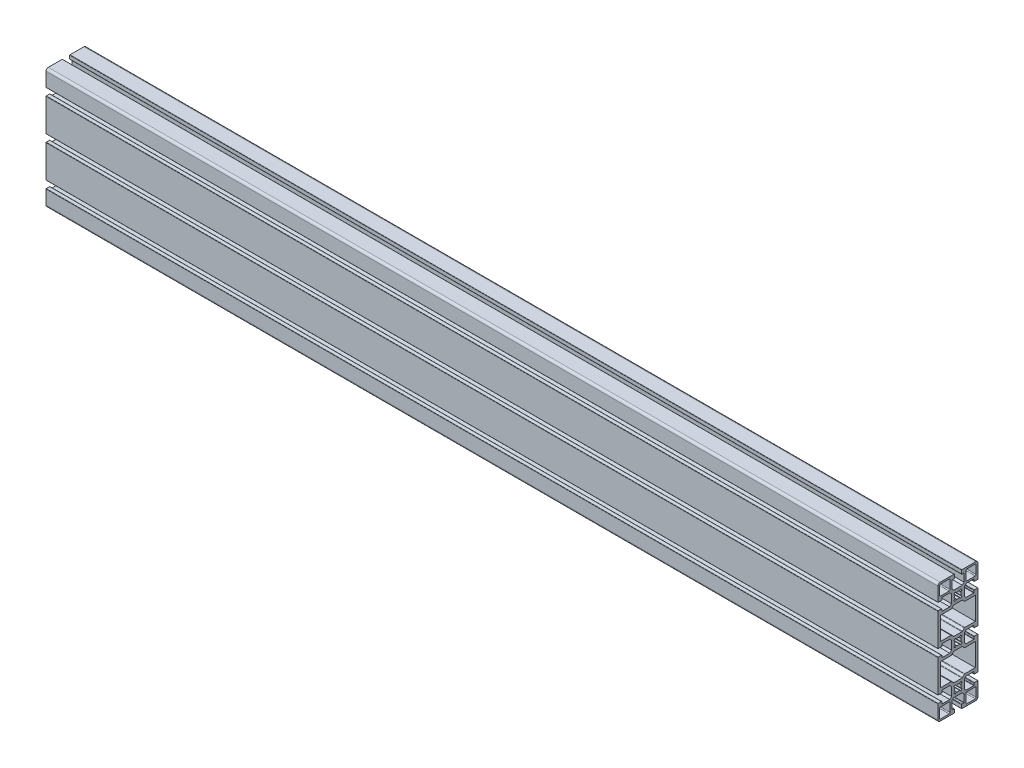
SolidWorks part; units mm, degrees
ref_plane "Front Plane" through (0, 0, 0) normal (0, 0, 1) x (1, 0, 0)
ref_plane "Top Plane" through (0, 0, 0) normal (0, 1, 0) x (1, 0, 0)
ref_plane "Right Plane" through (0, 0, 0) normal (1, 0, 0) x (0, 0, -1)
sketch3d "3DSketch1"
  line L0 (0, 0, 0) -> (1000, 0, 0)
  dimension "D1" = 1000
other "45-sarja 1.0115 45X135 L 6M MUSTA(1)"
ref_plane "Plane1" through (0, 0, 0) normal (1, 0, 0) x (0, 0, -1)
sketch "Sketch12" plane through (0, 0, 0) normal (1, 0, 0) x (0, 0, -1)
  line L0 (9.8, 53.9275) -> (19.5, 53.9275)
  line L1 (20.5, 54.9275) -> (20.5, 64.6275)
  line L2 (19.5, 65.6275) -> (9.8, 65.6275)
  line L3 (8.8, 64.6275) -> (8.8, 54.9275)
  line L4 (-20.5, 64.6275) -> (-20.5, 54.9275)
  line L5 (-19.5, 53.9275) -> (-9.8, 53.9275)
  line L6 (-8.8, 54.9275) -> (-8.8, 64.6275)
  line L7 (-9.8, 65.6275) -> (-19.5, 65.6275)
  line L8 (-4.3841, 48.0973) -> (-3.3633, 47.0766)
  line L9 (-3.3633, 43.1784) -> (-4.3841, 42.1576)
  line L10 (-4.3841, 41.7334) -> (-3.3941, 40.7434)
  line L11 (-2.9698, 40.7434) -> (-1.9491, 41.7642)
  line L12 (1.9491, 41.7642) -> (2.9698, 40.7434)
  line L13 (3.3941, 40.7434) -> (4.3841, 41.7334)
  line L14 (4.3841, 42.1576) -> (3.3633, 43.1784)
  line L15 (3.3633, 47.0766) -> (4.3841, 48.0973)
  line L16 (4.3841, 48.5216) -> (3.3941, 49.5115)
  line L17 (2.9698, 49.5115) -> (1.9491, 48.4908)
  line L18 (-1.9491, 48.4908) -> (-2.9698, 49.5115)
  line L19 (-3.3941, 49.5115) -> (-4.3841, 48.5216)
  line L20 (-5.0929, 37.6346) -> (-7.1071, 35.6204)
  line L21 (4.3858, 37.9275) -> (-4.3858, 37.9275)
  line L22 (7.1071, 35.6204) -> (5.0929, 37.6346)
  line L23 (19.5, 35.3275) -> (7.8142, 35.3275)
  line L24 (19.5, 9.9275) -> (19.5, 35.3275)
  line L25 (7.8142, 9.9275) -> (19.5, 9.9275)
  line L26 (5.0929, 7.6204) -> (7.1071, 9.6346)
  line L27 (-4.3858, 7.3275) -> (4.3858, 7.3275)
  line L28 (-7.1071, 9.6346) -> (-5.0929, 7.6204)
  line L29 (-19.5, 9.9275) -> (-7.8142, 9.9275)
  line L30 (-19.5, 35.3275) -> (-19.5, 9.9275)
  line L31 (-7.8142, 35.3275) -> (-19.5, 35.3275)
  line L32 (-4.3841, 3.0973) -> (-3.3633, 2.0766)
  line L33 (-3.3633, -1.8216) -> (-4.3841, -2.8424)
  line L34 (-4.3841, -3.2666) -> (-3.3941, -4.2566)
  line L35 (-2.9698, -4.2566) -> (-1.9491, -3.2358)
  line L36 (1.9491, -3.2358) -> (2.9698, -4.2566)
  line L37 (3.3941, -4.2566) -> (4.3841, -3.2666)
  line L38 (4.3841, -2.8424) -> (3.3633, -1.8216)
  line L39 (3.3633, 2.0766) -> (4.3841, 3.0973)
  line L40 (-18.5, 41.0275) -> (-22.2, 41.0275)
  line L41 (-22.5, 40.7275) -> (-22.5, 4.5275)
  line L42 (-22.2, 4.2275) -> (-18.5, 4.2275)
  line L43 (-18, 4.7275) -> (-18, 6.6275)
  line L44 (-17.7, 6.9275) -> (-9.2, 6.9275)
  line L45 (-9.2, 6.9275) -> (-7.2, 4.9275)
  line L46 (-7.2, 4.9275) -> (-7.2, -4.6725)
  line L47 (-7.2, -4.6725) -> (-9.2, -6.6725)
  line L48 (-9.2, -6.6725) -> (-17.7, -6.6725)
  line L49 (-18, -6.3725) -> (-18, -4.4725)
  line L50 (-18.5, -3.9725) -> (-22.2, -3.9725)
  line L51 (-22.5, -4.2725) -> (-22.5, -40.4725)
  line L52 (-22.2, -40.7725) -> (-18.5, -40.7725)
  line L53 (-18, -40.2725) -> (-18, -38.3725)
  line L54 (-17.7, -38.0725) -> (-9.2, -38.0725)
  line L55 (-9.2, -38.0725) -> (-7.2, -40.0725)
  line L56 (-7.2, -40.0725) -> (-7.2, -49.6725)
  line L57 (-7.2, -49.6725) -> (-9.2, -51.6725)
  line L58 (-9.2, -51.6725) -> (-17.7, -51.6725)
  line L59 (-18, -51.3725) -> (-18, -49.4725)
  line L60 (-18.5, -48.9725) -> (-22.2, -48.9725)
  line L61 (-22.5, -49.2725) -> (-22.5, -64.8725)
  line L62 (-20, -67.3725) -> (-4.4, -67.3725)
  line L63 (-4.1, -67.0725) -> (-4.1, -63.3725)
  line L64 (-4.6, -62.8725) -> (-6.5, -62.8725)
  line L65 (-6.8, -62.5725) -> (-6.8, -54.0725)
  line L66 (-6.8, -54.0725) -> (-4.8, -52.0725)
  line L67 (-4.8, -52.0725) -> (4.8, -52.0725)
  line L68 (4.8, -52.0725) -> (6.8, -54.0725)
  line L69 (6.8, -54.0725) -> (6.8, -62.5725)
  line L70 (6.5, -62.8725) -> (4.6, -62.8725)
  line L71 (4.1, -63.3725) -> (4.1, -67.0725)
  line L72 (4.4, -67.3725) -> (20, -67.3725)
  line L73 (22.5, -64.8725) -> (22.5, -49.2725)
  line L74 (22.2, -48.9725) -> (18.5, -48.9725)
  line L75 (18, -49.4725) -> (18, -51.3725)
  line L76 (17.7, -51.6725) -> (9.2, -51.6725)
  line L77 (9.2, -51.6725) -> (7.2, -49.6725)
  line L78 (7.2, -49.6725) -> (7.2, -40.0725)
  line L79 (7.2, -40.0725) -> (9.2, -38.0725)
  line L80 (9.2, -38.0725) -> (17.7, -38.0725)
  line L81 (18, -38.3725) -> (18, -40.2725)
  line L82 (18.5, -40.7725) -> (22.2, -40.7725)
  line L83 (22.5, -40.4725) -> (22.5, -4.2725)
  line L84 (22.2, -3.9725) -> (18.5, -3.9725)
  line L85 (18, -4.4725) -> (18, -6.3725)
  line L86 (17.7, -6.6725) -> (9.2, -6.6725)
  line L87 (9.2, -6.6725) -> (7.2, -4.6725)
  line L88 (7.2, -4.6725) -> (7.2, 4.9275)
  line L89 (7.2, 4.9275) -> (9.2, 6.9275)
  line L90 (9.2, 6.9275) -> (17.7, 6.9275)
  line L91 (18, 6.6275) -> (18, 4.7275)
  line L92 (18.5, 4.2275) -> (22.2, 4.2275)
  line L93 (22.5, 4.5275) -> (22.5, 40.7275)
  line L94 (22.2, 41.0275) -> (18.5, 41.0275)
  line L95 (18, 40.5275) -> (18, 38.6275)
  line L96 (17.7, 38.3275) -> (9.2, 38.3275)
  line L97 (9.2, 38.3275) -> (7.2, 40.3275)
  line L98 (7.2, 40.3275) -> (7.2, 49.9275)
  line L99 (7.2, 49.9275) -> (9.2, 51.9275)
  line L100 (9.2, 51.9275) -> (17.7, 51.9275)
  line L101 (18, 51.6275) -> (18, 49.7275)
  line L102 (18.5, 49.2275) -> (22.2, 49.2275)
  line L103 (22.5, 49.5275) -> (22.5, 65.1275)
  line L104 (20, 67.6275) -> (4.4, 67.6275)
  line L105 (4.1, 67.3275) -> (4.1, 63.6275)
  line L106 (4.6, 63.1275) -> (6.5, 63.1275)
  line L107 (6.8, 62.8275) -> (6.8, 54.3275)
  line L108 (6.8, 54.3275) -> (4.8, 52.3275)
  line L109 (4.8, 52.3275) -> (-4.8, 52.3275)
  line L110 (-4.8, 52.3275) -> (-6.8, 54.3275)
  line L111 (-6.8, 54.3275) -> (-6.8, 62.8275)
  line L112 (-6.5, 63.1275) -> (-4.6, 63.1275)
  line L113 (-4.1, 63.6275) -> (-4.1, 67.3275)
  line L114 (-4.4, 67.6275) -> (-20, 67.6275)
  line L115 (-22.5, 65.1275) -> (-22.5, 49.5275)
  line L116 (-22.2, 49.2275) -> (-18.5, 49.2275)
  line L117 (-18, 49.7275) -> (-18, 51.6275)
  line L118 (-17.7, 51.9275) -> (-9.2, 51.9275)
  line L119 (-9.2, 51.9275) -> (-7.2, 49.9275)
  line L120 (-7.2, 49.9275) -> (-7.2, 40.3275)
  line L121 (-7.2, 40.3275) -> (-9.2, 38.3275)
  line L122 (-9.2, 38.3275) -> (-17.7, 38.3275)
  line L123 (-18, 38.6275) -> (-18, 40.5275)
  line L124 (4.3841, 3.5216) -> (3.3941, 4.5115)
  line L125 (2.9698, 4.5115) -> (1.9491, 3.4908)
  line L126 (-1.9491, 3.4908) -> (-2.9698, 4.5115)
  line L127 (-3.3941, 4.5115) -> (-4.3841, 3.5216)
  line L128 (-5.0929, -7.3654) -> (-7.1071, -9.3796)
  line L129 (-7.8142, -9.6725) -> (-19.5, -9.6725)
  line L130 (-19.5, -9.6725) -> (-19.5, -35.0725)
  line L131 (-19.5, -35.0725) -> (-7.8142, -35.0725)
  line L132 (-7.1071, -35.3654) -> (-5.0929, -37.3796)
  line L133 (-4.3858, -37.6725) -> (4.3858, -37.6725)
  line L134 (5.0929, -37.3796) -> (7.1071, -35.3654)
  line L135 (7.8142, -35.0725) -> (19.5, -35.0725)
  line L136 (19.5, -35.0725) -> (19.5, -9.6725)
  line L137 (19.5, -9.6725) -> (7.8142, -9.6725)
  line L138 (7.1071, -9.3796) -> (5.0929, -7.3654)
  line L139 (4.3858, -7.0725) -> (-4.3858, -7.0725)
  line L140 (-4.3841, -41.9027) -> (-3.3633, -42.9234)
  line L141 (-3.3633, -46.8216) -> (-4.3841, -47.8424)
  line L142 (-4.3841, -48.2666) -> (-3.3941, -49.2566)
  line L143 (-2.9698, -49.2566) -> (-1.9491, -48.2358)
  line L144 (1.9491, -48.2358) -> (2.9698, -49.2566)
  line L145 (3.3941, -49.2566) -> (4.3841, -48.2666)
  line L146 (4.3841, -47.8424) -> (3.3633, -46.8216)
  line L147 (3.3633, -42.9234) -> (4.3841, -41.9027)
  line L148 (4.3841, -41.4784) -> (3.3941, -40.4885)
  line L149 (2.9698, -40.4885) -> (1.9491, -41.5092)
  line L150 (-1.9491, -41.5092) -> (-2.9698, -40.4885)
  line L151 (-3.3941, -40.4885) -> (-4.3841, -41.4784)
  line L152 (-19.5, -65.3725) -> (-9.8, -65.3725)
  line L153 (-8.8, -64.3725) -> (-8.8, -54.6725)
  line L154 (-20.5, -54.6725) -> (-20.5, -64.3725)
  line L155 (-9.8, -53.6725) -> (-19.5, -53.6725)
  line L156 (8.8, -54.6725) -> (8.8, -64.3725)
  line L157 (9.8, -65.3725) -> (19.5, -65.3725)
  line L158 (20.5, -64.3725) -> (20.5, -54.6725)
  line L159 (19.5, -53.6725) -> (9.8, -53.6725)
  arc A0 (19.5, 53.9275) -> (20.5, 54.9275) centre (19.5, 54.9275) ccw
  arc A1 (20.5, 64.6275) -> (19.5, 65.6275) centre (19.5, 64.6275) ccw
  arc A2 (9.8, 65.6275) -> (8.8, 64.6275) centre (9.8, 64.6275) ccw
  arc A3 (8.8, 54.9275) -> (9.8, 53.9275) centre (9.8, 54.9275) ccw
  arc A4 (-20.5, 54.9275) -> (-19.5, 53.9275) centre (-19.5, 54.9275) ccw
  arc A5 (-9.8, 53.9275) -> (-8.8, 54.9275) centre (-9.8, 54.9275) ccw
  arc A6 (-8.8, 64.6275) -> (-9.8, 65.6275) centre (-9.8, 64.6275) ccw
  arc A7 (-19.5, 65.6275) -> (-20.5, 64.6275) centre (-19.5, 64.6275) ccw
  arc A8 (-4.3841, 48.5216) -> (-4.3841, 48.0973) centre (-4.1719, 48.3095) ccw
  arc A9 (-3.3056, 46.7333) -> (-3.3633, 47.0766) centre (-3.5754, 46.8644) ccw
  arc A10 (-3.3056, 46.7333) -> (-3.3056, 43.5216) centre (0, 45.1275) ccw
  arc A11 (-3.3633, 43.1784) -> (-3.3056, 43.5216) centre (-3.5754, 43.3905) ccw
  arc A12 (-4.3841, 42.1576) -> (-4.3841, 41.7334) centre (-4.1719, 41.9455) ccw
  arc A13 (-3.3941, 40.7434) -> (-2.9698, 40.7434) centre (-3.182, 40.9556) ccw
  arc A14 (-1.6059, 41.8219) -> (-1.9491, 41.7642) centre (-1.7369, 41.5521) ccw
  arc A15 (-1.6059, 41.8219) -> (1.6059, 41.8219) centre (0, 45.1275) ccw
  arc A16 (1.9491, 41.7642) -> (1.6059, 41.8219) centre (1.7369, 41.5521) ccw
  arc A17 (2.9698, 40.7434) -> (3.3941, 40.7434) centre (3.182, 40.9556) ccw
  arc A18 (4.3841, 41.7334) -> (4.3841, 42.1576) centre (4.1719, 41.9455) ccw
  arc A19 (3.3056, 43.5216) -> (3.3633, 43.1784) centre (3.5754, 43.3905) ccw
  arc A20 (3.3056, 43.5216) -> (3.3056, 46.7333) centre (0, 45.1275) ccw
  arc A21 (3.3633, 47.0766) -> (3.3056, 46.7333) centre (3.5754, 46.8644) ccw
  arc A22 (4.3841, 48.0973) -> (4.3841, 48.5216) centre (4.1719, 48.3095) ccw
  arc A23 (3.3941, 49.5115) -> (2.9698, 49.5115) centre (3.182, 49.2994) ccw
  arc A24 (-18, 40.5275) -> (-18.5, 41.0275) centre (-18.5, 40.5275) ccw
  arc A25 (-22.2, 41.0275) -> (-22.5, 40.7275) centre (-22.2, 40.7275) ccw
  arc A26 (-22.5, 4.5275) -> (-22.2, 4.2275) centre (-22.2, 4.5275) ccw
  arc A27 (-18.5, 4.2275) -> (-18, 4.7275) centre (-18.5, 4.7275) ccw
  arc A28 (-17.7, 6.9275) -> (-18, 6.6275) centre (-17.7, 6.6275) ccw
  arc A29 (-18, -6.3725) -> (-17.7, -6.6725) centre (-17.7, -6.3725) ccw
  arc A30 (-18, -4.4725) -> (-18.5, -3.9725) centre (-18.5, -4.4725) ccw
  arc A31 (-22.2, -3.9725) -> (-22.5, -4.2725) centre (-22.2, -4.2725) ccw
  arc A32 (-22.5, -40.4725) -> (-22.2, -40.7725) centre (-22.2, -40.4725) ccw
  arc A33 (-18.5, -40.7725) -> (-18, -40.2725) centre (-18.5, -40.2725) ccw
  arc A34 (-17.7, -38.0725) -> (-18, -38.3725) centre (-17.7, -38.3725) ccw
  arc A35 (-18, -51.3725) -> (-17.7, -51.6725) centre (-17.7, -51.3725) ccw
  arc A36 (-18, -49.4725) -> (-18.5, -48.9725) centre (-18.5, -49.4725) ccw
  arc A37 (-22.2, -48.9725) -> (-22.5, -49.2725) centre (-22.2, -49.2725) ccw
  arc A38 (-22.5, -64.8725) -> (-20, -67.3725) centre (-20, -64.8725) ccw
  arc A39 (-4.4, -67.3725) -> (-4.1, -67.0725) centre (-4.4, -67.0725) ccw
  arc A40 (-4.1, -63.3725) -> (-4.6, -62.8725) centre (-4.6, -63.3725) ccw
  arc A41 (-6.8, -62.5725) -> (-6.5, -62.8725) centre (-6.5, -62.5725) ccw
  arc A42 (6.5, -62.8725) -> (6.8, -62.5725) centre (6.5, -62.5725) ccw
  arc A43 (4.6, -62.8725) -> (4.1, -63.3725) centre (4.6, -63.3725) ccw
  arc A44 (4.1, -67.0725) -> (4.4, -67.3725) centre (4.4, -67.0725) ccw
  arc A45 (20, -67.3725) -> (22.5, -64.8725) centre (20, -64.8725) ccw
  arc A46 (22.5, -49.2725) -> (22.2, -48.9725) centre (22.2, -49.2725) ccw
  arc A47 (18.5, -48.9725) -> (18, -49.4725) centre (18.5, -49.4725) ccw
  arc A48 (17.7, -51.6725) -> (18, -51.3725) centre (17.7, -51.3725) ccw
  arc A49 (18, -38.3725) -> (17.7, -38.0725) centre (17.7, -38.3725) ccw
  arc A50 (18, -40.2725) -> (18.5, -40.7725) centre (18.5, -40.2725) ccw
  arc A51 (22.2, -40.7725) -> (22.5, -40.4725) centre (22.2, -40.4725) ccw
  arc A52 (22.5, -4.2725) -> (22.2, -3.9725) centre (22.2, -4.2725) ccw
  arc A53 (18.5, -3.9725) -> (18, -4.4725) centre (18.5, -4.4725) ccw
  arc A54 (17.7, -6.6725) -> (18, -6.3725) centre (17.7, -6.3725) ccw
  arc A55 (18, 6.6275) -> (17.7, 6.9275) centre (17.7, 6.6275) ccw
  arc A56 (18, 4.7275) -> (18.5, 4.2275) centre (18.5, 4.7275) ccw
  arc A57 (22.2, 4.2275) -> (22.5, 4.5275) centre (22.2, 4.5275) ccw
  arc A58 (22.5, 40.7275) -> (22.2, 41.0275) centre (22.2, 40.7275) ccw
  arc A59 (18.5, 41.0275) -> (18, 40.5275) centre (18.5, 40.5275) ccw
  arc A60 (17.7, 38.3275) -> (18, 38.6275) centre (17.7, 38.6275) ccw
  arc A61 (18, 51.6275) -> (17.7, 51.9275) centre (17.7, 51.6275) ccw
  arc A62 (18, 49.7275) -> (18.5, 49.2275) centre (18.5, 49.7275) ccw
  arc A63 (22.2, 49.2275) -> (22.5, 49.5275) centre (22.2, 49.5275) ccw
  arc A64 (22.5, 65.1275) -> (20, 67.6275) centre (20, 65.1275) ccw
  arc A65 (4.4, 67.6275) -> (4.1, 67.3275) centre (4.4, 67.3275) ccw
  arc A66 (4.1, 63.6275) -> (4.6, 63.1275) centre (4.6, 63.6275) ccw
  arc A67 (6.8, 62.8275) -> (6.5, 63.1275) centre (6.5, 62.8275) ccw
  arc A68 (-6.5, 63.1275) -> (-6.8, 62.8275) centre (-6.5, 62.8275) ccw
  arc A69 (-4.6, 63.1275) -> (-4.1, 63.6275) centre (-4.6, 63.6275) ccw
  arc A70 (-4.1, 67.3275) -> (-4.4, 67.6275) centre (-4.4, 67.3275) ccw
  arc A71 (-20, 67.6275) -> (-22.5, 65.1275) centre (-20, 65.1275) ccw
  arc A72 (-22.5, 49.5275) -> (-22.2, 49.2275) centre (-22.2, 49.5275) ccw
  arc A73 (-18.5, 49.2275) -> (-18, 49.7275) centre (-18.5, 49.7275) ccw
  arc A74 (-17.7, 51.9275) -> (-18, 51.6275) centre (-17.7, 51.6275) ccw
  arc A75 (-18, 38.6275) -> (-17.7, 38.3275) centre (-17.7, 38.6275) ccw
  arc A76 (1.6059, 48.4331) -> (1.9491, 48.4908) centre (1.7369, 48.7029) ccw
  arc A77 (1.6059, 48.4331) -> (-1.6059, 48.4331) centre (0, 45.1275) ccw
  arc A78 (-1.9491, 48.4908) -> (-1.6059, 48.4331) centre (-1.7369, 48.7029) ccw
  arc A79 (-2.9698, 49.5115) -> (-3.3941, 49.5115) centre (-3.182, 49.2994) ccw
  arc A80 (-7.8142, 35.3275) -> (-7.1071, 35.6204) centre (-7.8142, 36.3275) ccw
  arc A81 (-4.3858, 37.9275) -> (-5.0929, 37.6346) centre (-4.3858, 36.9275) ccw
  arc A82 (5.0929, 37.6346) -> (4.3858, 37.9275) centre (4.3858, 36.9275) ccw
  arc A83 (7.1071, 35.6204) -> (7.8142, 35.3275) centre (7.8142, 36.3275) ccw
  arc A84 (7.8142, 9.9275) -> (7.1071, 9.6346) centre (7.8142, 8.9275) ccw
  arc A85 (4.3858, 7.3275) -> (5.0929, 7.6204) centre (4.3858, 8.3275) ccw
  arc A86 (-5.0929, 7.6204) -> (-4.3858, 7.3275) centre (-4.3858, 8.3275) ccw
  arc A87 (-7.1071, 9.6346) -> (-7.8142, 9.9275) centre (-7.8142, 8.9275) ccw
  arc A88 (-4.3841, 3.5216) -> (-4.3841, 3.0973) centre (-4.1719, 3.3095) ccw
  arc A89 (-3.3056, 1.7333) -> (-3.3633, 2.0766) centre (-3.5754, 1.8644) ccw
  arc A90 (-3.3056, 1.7333) -> (-3.3056, -1.4784) centre (0, 0.1275) ccw
  arc A91 (-3.3633, -1.8216) -> (-3.3056, -1.4784) centre (-3.5754, -1.6095) ccw
  arc A92 (-4.3841, -2.8424) -> (-4.3841, -3.2666) centre (-4.1719, -3.0545) ccw
  arc A93 (-3.3941, -4.2566) -> (-2.9698, -4.2566) centre (-3.182, -4.0444) ccw
  arc A94 (-1.6059, -3.1781) -> (-1.9491, -3.2358) centre (-1.7369, -3.4479) ccw
  arc A95 (-1.6059, -3.1781) -> (1.6059, -3.1781) centre (0, 0.1275) ccw
  arc A96 (1.9491, -3.2358) -> (1.6059, -3.1781) centre (1.7369, -3.4479) ccw
  arc A97 (2.9698, -4.2566) -> (3.3941, -4.2566) centre (3.182, -4.0444) ccw
  arc A98 (4.3841, -3.2666) -> (4.3841, -2.8424) centre (4.1719, -3.0545) ccw
  arc A99 (3.3056, -1.4784) -> (3.3633, -1.8216) centre (3.5754, -1.6095) ccw
  arc A100 (3.3056, -1.4784) -> (3.3056, 1.7333) centre (0, 0.1275) ccw
  arc A101 (3.3633, 2.0766) -> (3.3056, 1.7333) centre (3.5754, 1.8644) ccw
  arc A102 (4.3841, 3.0973) -> (4.3841, 3.5216) centre (4.1719, 3.3095) ccw
  arc A103 (3.3941, 4.5115) -> (2.9698, 4.5115) centre (3.182, 4.2994) ccw
  arc A104 (1.6059, 3.4331) -> (1.9491, 3.4908) centre (1.7369, 3.7029) ccw
  arc A105 (1.6059, 3.4331) -> (-1.6059, 3.4331) centre (0, 0.1275) ccw
  arc A106 (-1.9491, 3.4908) -> (-1.6059, 3.4331) centre (-1.7369, 3.7029) ccw
  arc A107 (-2.9698, 4.5115) -> (-3.3941, 4.5115) centre (-3.182, 4.2994) ccw
  arc A108 (-7.8142, -9.6725) -> (-7.1071, -9.3796) centre (-7.8142, -8.6725) ccw
  arc A109 (-7.1071, -35.3654) -> (-7.8142, -35.0725) centre (-7.8142, -36.0725) ccw
  arc A110 (-5.0929, -37.3796) -> (-4.3858, -37.6725) centre (-4.3858, -36.6725) ccw
  arc A111 (4.3858, -37.6725) -> (5.0929, -37.3796) centre (4.3858, -36.6725) ccw
  arc A112 (7.8142, -35.0725) -> (7.1071, -35.3654) centre (7.8142, -36.0725) ccw
  arc A113 (7.1071, -9.3796) -> (7.8142, -9.6725) centre (7.8142, -8.6725) ccw
  arc A114 (5.0929, -7.3654) -> (4.3858, -7.0725) centre (4.3858, -8.0725) ccw
  arc A115 (-4.3858, -7.0725) -> (-5.0929, -7.3654) centre (-4.3858, -8.0725) ccw
  arc A116 (-4.3841, -41.4784) -> (-4.3841, -41.9027) centre (-4.1719, -41.6905) ccw
  arc A117 (-3.3056, -43.2667) -> (-3.3633, -42.9234) centre (-3.5754, -43.1356) ccw
  arc A118 (-3.3056, -43.2667) -> (-3.3056, -46.4784) centre (0, -44.8725) ccw
  arc A119 (-3.3633, -46.8216) -> (-3.3056, -46.4784) centre (-3.5754, -46.6095) ccw
  arc A120 (-4.3841, -47.8424) -> (-4.3841, -48.2666) centre (-4.1719, -48.0545) ccw
  arc A121 (-3.3941, -49.2566) -> (-2.9698, -49.2566) centre (-3.182, -49.0444) ccw
  arc A122 (-1.6059, -48.1781) -> (-1.9491, -48.2358) centre (-1.7369, -48.4479) ccw
  arc A123 (-1.6059, -48.1781) -> (1.6059, -48.1781) centre (0, -44.8725) ccw
  arc A124 (1.9491, -48.2358) -> (1.6059, -48.1781) centre (1.7369, -48.4479) ccw
  arc A125 (2.9698, -49.2566) -> (3.3941, -49.2566) centre (3.182, -49.0444) ccw
  arc A126 (4.3841, -48.2666) -> (4.3841, -47.8424) centre (4.1719, -48.0545) ccw
  arc A127 (3.3056, -46.4784) -> (3.3633, -46.8216) centre (3.5754, -46.6095) ccw
  arc A128 (3.3056, -46.4784) -> (3.3056, -43.2667) centre (0, -44.8725) ccw
  arc A129 (3.3633, -42.9234) -> (3.3056, -43.2667) centre (3.5754, -43.1356) ccw
  arc A130 (4.3841, -41.9027) -> (4.3841, -41.4784) centre (4.1719, -41.6905) ccw
  arc A131 (3.3941, -40.4885) -> (2.9698, -40.4885) centre (3.182, -40.7006) ccw
  arc A132 (1.6059, -41.5669) -> (1.9491, -41.5092) centre (1.7369, -41.2971) ccw
  arc A133 (1.6059, -41.5669) -> (-1.6059, -41.5669) centre (0, -44.8725) ccw
  arc A134 (-1.9491, -41.5092) -> (-1.6059, -41.5669) centre (-1.7369, -41.2971) ccw
  arc A135 (-2.9698, -40.4885) -> (-3.3941, -40.4885) centre (-3.182, -40.7006) ccw
  arc A136 (-20.5, -64.3725) -> (-19.5, -65.3725) centre (-19.5, -64.3725) ccw
  arc A137 (-9.8, -65.3725) -> (-8.8, -64.3725) centre (-9.8, -64.3725) ccw
  arc A138 (-8.8, -54.6725) -> (-9.8, -53.6725) centre (-9.8, -54.6725) ccw
  arc A139 (-19.5, -53.6725) -> (-20.5, -54.6725) centre (-19.5, -54.6725) ccw
  arc A140 (9.8, -53.6725) -> (8.8, -54.6725) centre (9.8, -54.6725) ccw
  arc A141 (8.8, -64.3725) -> (9.8, -65.3725) centre (9.8, -64.3725) ccw
  arc A142 (19.5, -65.3725) -> (20.5, -64.3725) centre (19.5, -64.3725) ccw
  arc A143 (20.5, -54.6725) -> (19.5, -53.6725) centre (19.5, -54.6725) ccw
  point P439 (0, 0)
